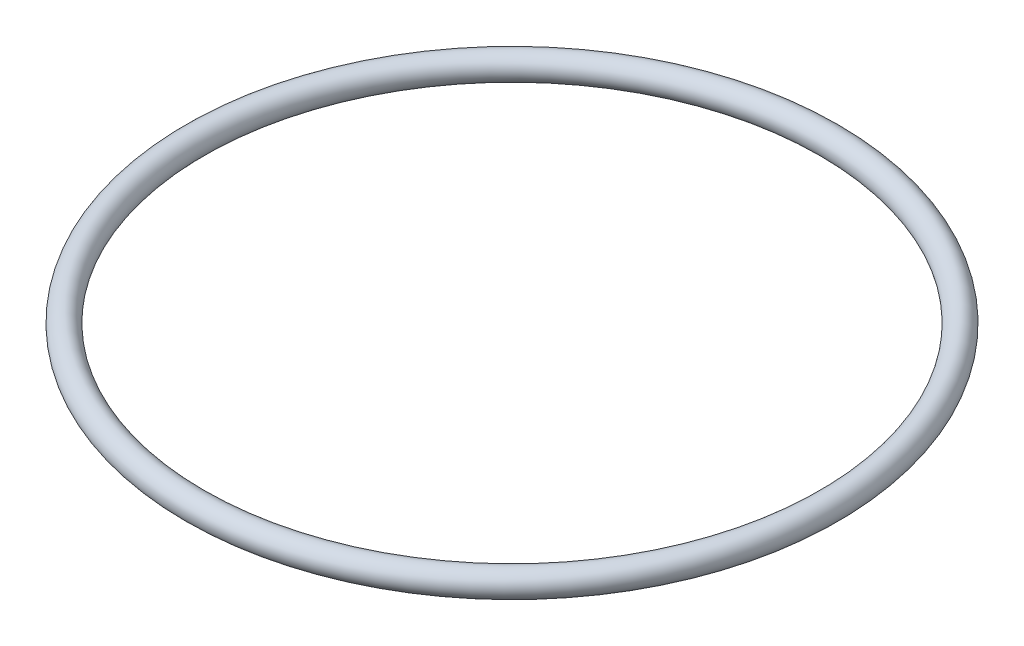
SolidWorks part; units mm, degrees
ref_plane "Front Plane" through (0, 0, 0) normal (0, 0, 1) x (1, 0, 0)
ref_plane "Top Plane" through (0, 0, 0) normal (0, 1, 0) x (1, 0, 0)
ref_plane "Right Plane" through (0, 0, 0) normal (1, 0, 0) x (0, 0, -1)
sketch "Sketch1" plane through (0, 0, 0) normal (0, 0, 1) x (1, 0, 0)
  line L0 (0, 0) -> (0, 25.3421) construction
  circle A0 centre (49.53, 0.7855) radius 1.9844
  dimension "D1" = 3.9688
  dimension "D2" = 49.53
revolve "Revolve1" add sketch "Sketch1" angle 360 about L0
